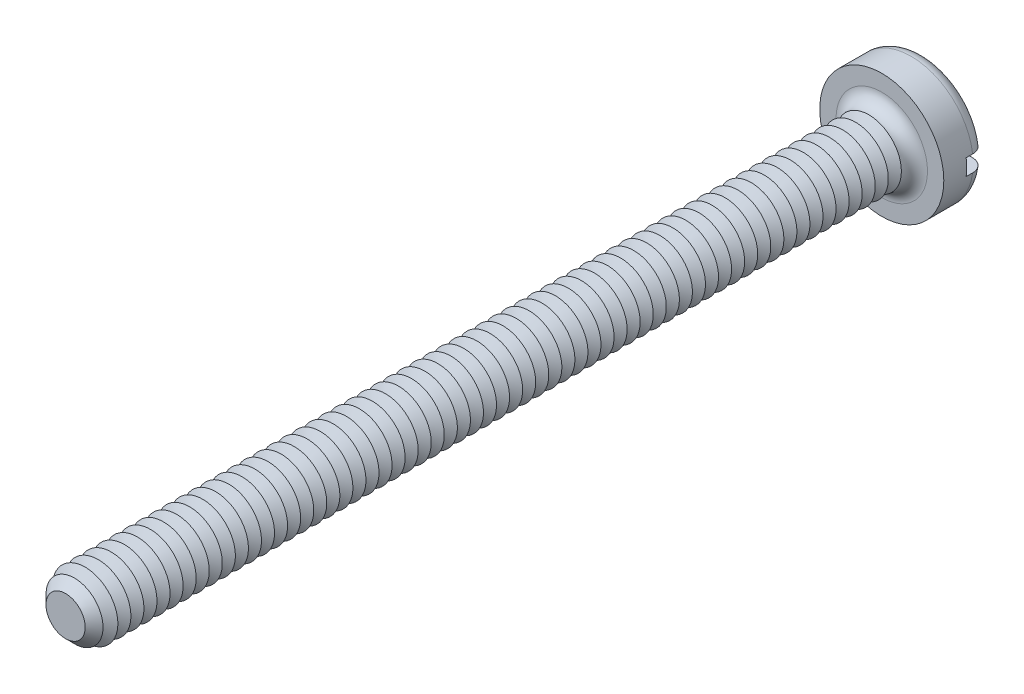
SolidWorks part; units mm, degrees
ref_plane "Front Plane" through (0, 0, 0) normal (0, 0, 1) x (1, 0, 0)
ref_plane "Top Plane" through (0, 0, 0) normal (0, 1, 0) x (1, 0, 0)
ref_plane "Right Plane" through (0, 0, 0) normal (1, 0, 0) x (0, 0, -1)
sketch "Sketch3" plane through (0, 0, 0) normal (0, 0, 1) x (1, 0, 0)
  circle A0 centre (0, 0) radius 1.9
  dimension "D1" = 3.8
extrude "Boss-Extrude2" add sketch "Sketch3" against normal blind 1.3
sketch "Sketch4" plane through (0, 0, 0) normal (0, 0, 1) x (1, 0, 0)
  circle A0 centre (0, 0) radius 1
  dimension "D1" = 2
extrude "Boss-Extrude3" add sketch "Sketch4" along normal blind 25
fillet "Fillet1" radius 0.4 2 edges at (1.9, 0, -1.3) (1, 0, 0)
chamfer "Chamfer1" distance 0.4 angle 45 1 edges at (1, 0, 25)
sketch "Sketch5" plane through (0, 0, 0) normal (1, 0, 0) x (0, 0, -1)
  line L0 (1.6944, 0) -> (-7.6738, 0) construction
sketch "Sketch6" plane through (0, 0, 0) normal (1, 0, 0) x (0, 0, -1)
  line L0 (-0.4, 1) -> (-0.6, 0.6536)
  line L1 (-0.6, 0.6536) -> (-0.8, 1)
  line L2 (-0.4, 1) -> (-24.6, 1) construction
  line L3 (-0.8, 1) -> (-0.4, 1)
  dimension "D1" = 0.4
revolve "Cut-Revolve1" cut sketch "Sketch6" angle 360 about L0
pattern_linear "LPattern1" count 61 spacing 0.4 along (0, 0, 1) of "Cut-Revolve1"
sketch "Sketch8" plane through (0, 0, -1.3) normal (0, 0, -1) x (-1, 0, 0)
  line L1 (1.9, -0.25) -> (-1.9, -0.25)
  line L2 (1.9, -0.25) -> (1.9, 0.25)
  line L3 (1.9, 0.25) -> (-1.9, 0.25)
  line L4 (-1.9, -0.25) -> (-1.9, 0.25)
  line L5 (1.9, -0.25) -> (-1.9, 0.25) construction
  line L6 (1.9, 0.25) -> (-1.9, -0.25) construction
  point P0 (0, 0)
  dimension "D1" = 3.8
  dimension "D2" = 0.5
extrude "Cut-Extrude1" cut sketch "Sketch8" against normal blind 0.6
